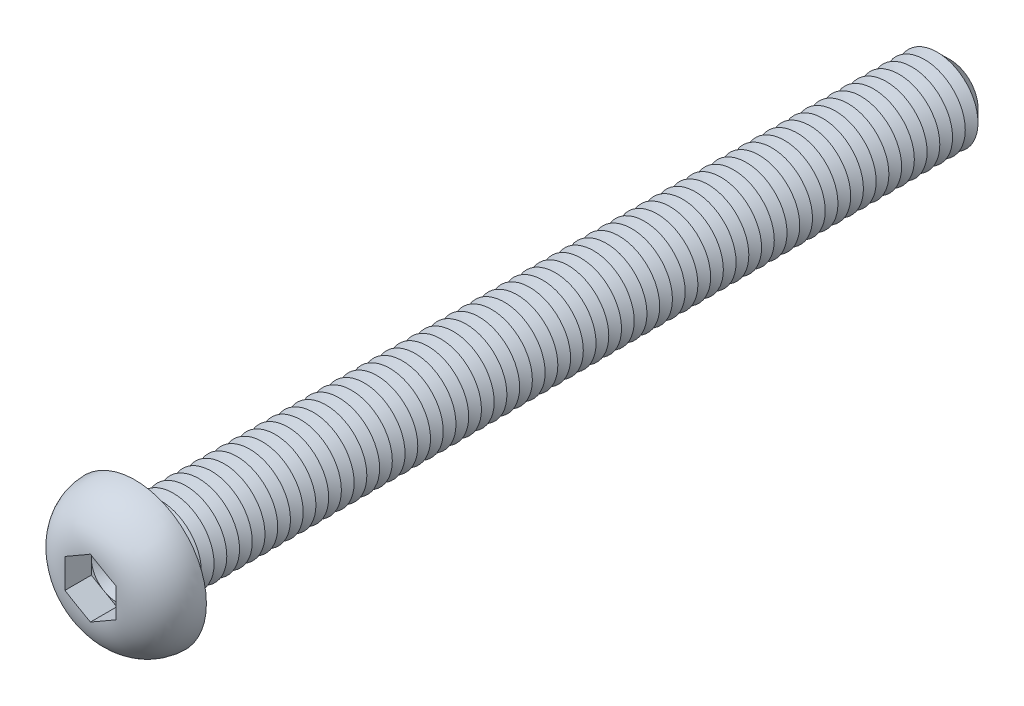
SolidWorks part; units mm, degrees
ref_plane "Front Plane" through (0, 0, 0) normal (0, 0, 1) x (1, 0, 0)
ref_plane "Top Plane" through (0, 0, 0) normal (0, 1, 0) x (1, 0, 0)
ref_plane "Right Plane" through (0, 0, 0) normal (1, 0, 0) x (0, 0, -1)
sketch "Sketch1" plane through (0, 0, 0) normal (1, 0, 0) x (0, 0, -1)
  line L0 (-47.9342, 0) -> (60.3146, 0) construction
sketch "Sketch2" plane through (0, 0, 0) normal (1, 0, 0) x (0, 0, -1)
  line L0 (0, 0) -> (-4.4, 0)
  line L1 (-47.9342, 0) -> (60.3146, 0) construction
  line L2 (-4.4, 0) -> (-4.4, 2.5011)
  line L3 (0, 7) -> (0, 0)
  arc A0 (-4.4, 2.5011) -> (0, 7) centre (0.1, 2.5011) cw
  dimension "D1" = 4.5
  dimension "D2" = 4.4
  dimension "D3" = 7
revolve "Revolve1" add sketch "Sketch2" angle 360 about L0
sketch "Sketch3" plane through (0, 0, 4.4) normal (0, 0, 1) x (1, 0, 0)
  line L1 (0, 2.8868) -> (-2.5, 1.4434)
  line L2 (-2.5, 1.4434) -> (-2.5, -1.4434)
  line L3 (-2.5, -1.4434) -> (0, -2.8868)
  line L4 (0, -2.8868) -> (2.5, -1.4434)
  line L5 (2.5, -1.4434) -> (2.5, 1.4434)
  line L6 (2.5, 1.4434) -> (0, 2.8868)
  circle A0 centre (0, 0) radius 2.5 construction
  dimension "D1" = 5
extrude "Cut-Extrude1" cut sketch "Sketch3" against normal blind 2.6
sketch "Sketch4" plane through (0, 0, 0) normal (0, 0, -1) x (-1, 0, 0)
  circle A0 centre (0, 0) radius 4
  dimension "D1" = 8
extrude "Boss-Extrude1" add sketch "Sketch4" along normal blind 80
chamfer "Chamfer1" distance 1.25 angle 45 1 edges at (-4, 0, -80)
sketch "Sketch5" plane through (0, 0, 0) normal (1, 0, 0) x (0, 0, -1)
  line L0 (1.25, 4) -> (2.5, 4)
  line L1 (78.75, 4) -> (0, 4) construction
  line L2 (2.5, 4) -> (1.875, 2.9175)
  line L3 (1.875, 2.9175) -> (1.25, 4)
  line L4 (0, -7) -> (0, 7) construction
  line L5 (78.75, 4) -> (0, 4) construction
  dimension "D1" = 1.25
  dimension "D2" = 1.25
revolve "Cut-Revolve1" cut sketch "Sketch5" angle 360 about L0
pattern_linear "LPattern1" count 62 spacing 1.25 along (0, 0, -1) of "Cut-Revolve1"
fillet "Fillet2" radius 0.5 1 edges at (4, 0, 0)
sketch "Sketch6" plane through (0, 0, 1.8) normal (0, 0, 1) x (1, 0, 0)
  line L0 (0, -2.8868) -> (2.5, -1.4434) construction
  circle A0 centre (0, 0) radius 2.5
extrude "Cut-Extrude2" cut sketch "Sketch6" against normal through all draft 60
